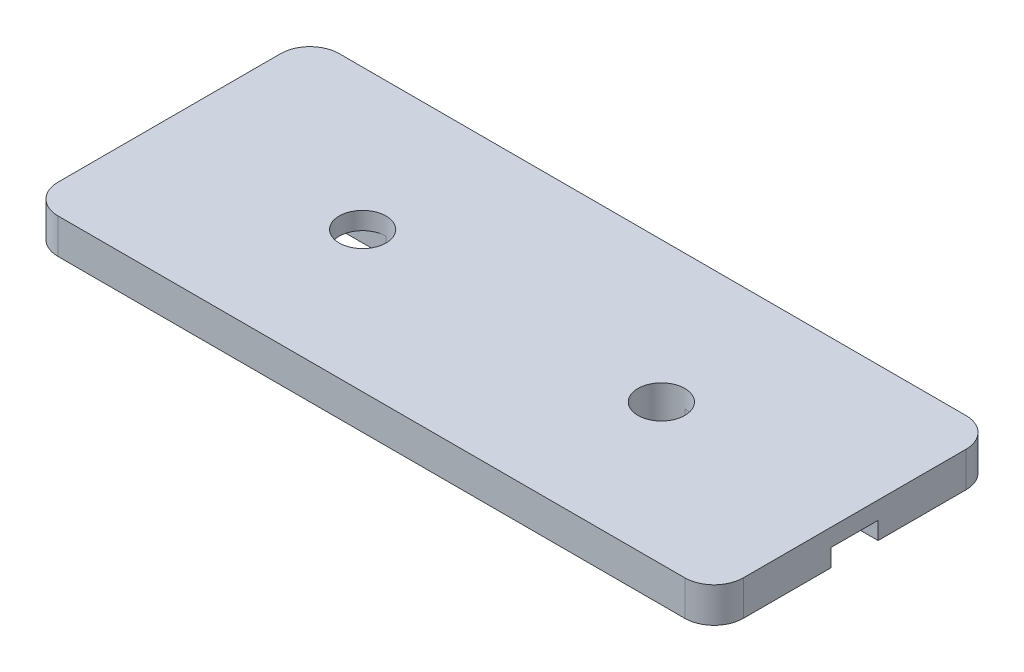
SolidWorks part; units mm, degrees
ref_plane "Plano frontal" through (0, 0, 0) normal (0, 0, 1) x (1, 0, 0)
ref_plane "Plano superior" through (0, 0, 0) normal (0, 1, 0) x (1, 0, 0)
ref_plane "Plano direito" through (0, 0, 0) normal (1, 0, 0) x (0, 0, -1)
sketch "Esboço1" plane through (0, 0, 0) normal (0, 1, 0) x (1, 0, 0)
  line L0 (-5.85, 2.4) -> (5.85, -2.4) construction
  line L1 (-5.85, 2.4) -> (5.85, 2.4)
  line L2 (-5.85, 2.4) -> (-5.85, -2.4)
  line L3 (-5.85, -2.4) -> (5.85, -2.4)
  line L4 (5.85, 2.4) -> (5.85, -2.4)
  dimension "D1" = 11.7
  dimension "D2" = 4.8
extrude "Extrusão1" add sketch "Esboço1" along normal blind 0.6
fillet "Filete1" radius 0.5 4 edges at (-5.85, 0.3, 2.4) (-5.85, 0.3, -2.4) (5.85, 0.3, -2.4) (5.85, 0.3, 2.4)
sketch "Esboço2" plane through (0, 0.6, 0) normal (0, 1, 0) x (1, 0, 0)
  line L0 (-5.85, 0) -> (5.85, 0) construction
  line L1 (-5.85, 1.9) -> (-5.85, -1.9) construction
  line L2 (5.85, -1.9) -> (5.85, 1.9) construction
  circle A0 centre (-2.55, 0) radius 0.4
  circle A1 centre (2.55, 0) radius 0.4
  dimension "D1" = 0.8
  dimension "D2" = 0.8
  dimension "D3" = 3.3
  dimension "D4" = 3.3
extrude "Extrusão2" cut sketch "Esboço2" against normal through all
sketch "Esboço3" plane through (-5.85, 0, 0) normal (-1, 0, 0) x (0, 0, 1)
  line L0 (-1.9, 0) -> (1.9, 0) construction
  line L1 (-0.4, 0.3) -> (0.4, 0.3)
  line L2 (-0.4, 0.3) -> (-0.4, 0)
  line L3 (-0.4, 0) -> (0.4, 0)
  line L4 (0.4, 0.3) -> (0.4, 0)
  point P4 (0, 0)
  dimension "D1" = 0.8
  dimension "D2" = 0.3
extrude "Extrusão3" cut sketch "Esboço3" against normal up to next
sketch "Esboço4" plane through (5.85, 0, 0) normal (1, 0, 0) x (0, 0, -1)
  line L0 (-1.9, 0) -> (1.9, 0) construction
  line L1 (-0.4, 0.3) -> (0.4, 0.3)
  line L2 (-0.4, 0.3) -> (-0.4, 0)
  line L3 (-0.4, 0) -> (0.4, 0)
  line L4 (0.4, 0.3) -> (0.4, 0)
  point P4 (0, 0)
  dimension "D1" = 0.8
  dimension "D2" = 0.3
extrude "Extrusão4" cut sketch "Esboço4" against normal up to next
